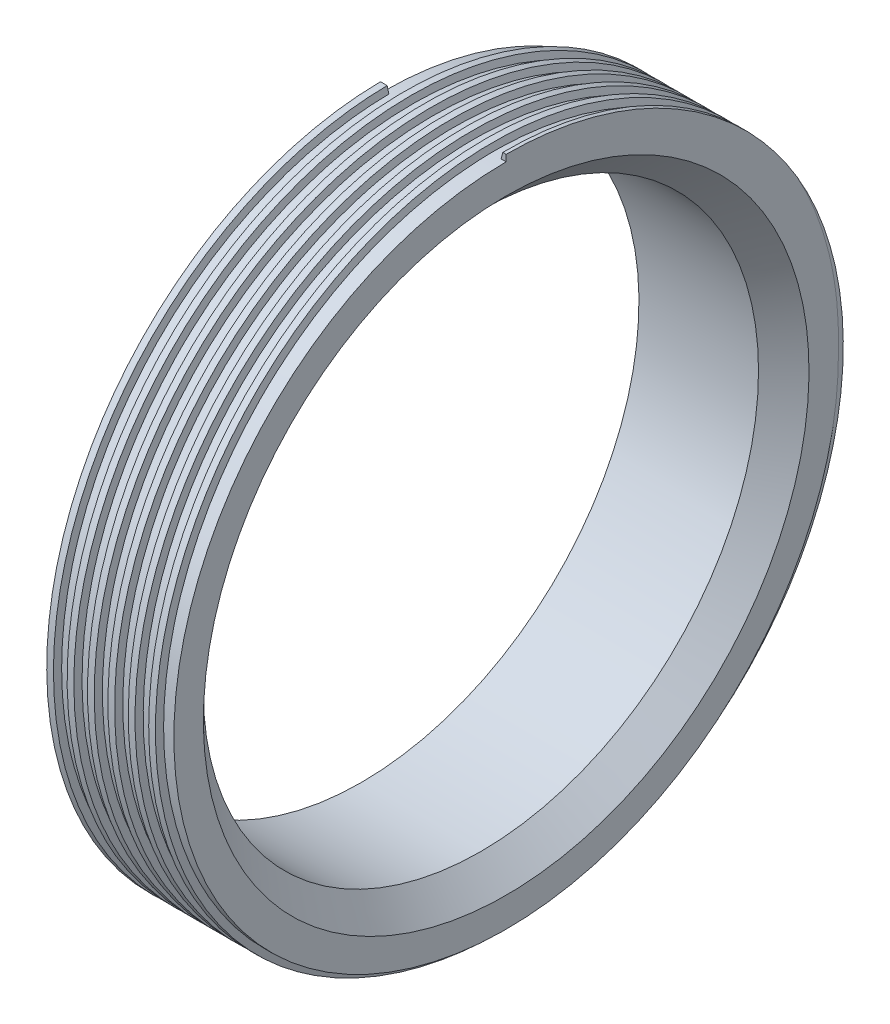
SolidWorks part; units mm, degrees
ref_plane "Front Plane" through (0, 0, 0) normal (0, 0, 1) x (1, 0, 0)
ref_plane "Top Plane" through (0, 0, 0) normal (0, 1, 0) x (1, 0, 0)
ref_plane "Right Plane" through (0, 0, 0) normal (1, 0, 0) x (0, 0, -1)
sketch "Sketch1" plane through (0, 0, 0) normal (0, 0, 1) x (1, 0, 0)
  line L0 (0, 0) -> (0, 50.8)
  line L1 (0, 50.8) -> (0.762, 50.8)
  line L2 (3.937, 53.975) -> (3.937, 59.436)
  line L3 (3.937, 59.436) -> (25.4, 59.436)
  line L4 (25.4, 59.436) -> (25.4, 0)
  line L5 (25.4, 0) -> (0, 0)
  arc A0 (3.937, 53.975) -> (0.762, 50.8) centre (0.762, 53.975) cw
  dimension ".125" = 3.175
  dimension "D1" = 50.8
  dimension "D2" = 21.463
  dimension "D3" = 25.4
  dimension "D4" = 59.436
revolve "Revolve1" add sketch "Sketch1" angle 360 about L5
sketch "Sketch3" plane through (25.4, 0, 0) normal (1, 0, 0) x (0, 0, -1)
  circle A1 centre (0, 0) radius 59.436
  circle A2 centre (0, 0) radius 59.436
  dimension "D1" = 0
curve "Helix/Spiral1"
sketch "Sketch10" plane through (25.4, 0, 0) normal (1, 0, 0) x (0, 0, -1)
  circle A2 centre (0, 0) radius 58.293
  circle A3 centre (0, 0) radius 58.293
  dimension "D1" = 1.143
extrude "Cut-Extrude14" cut sketch "Sketch10" against normal blind 21.463 flip side to cut
sketch "Sketch13" plane through (0, 0, 0) normal (0, 1, 0) x (1, 0, 0)
  line L0 (20.3405, 59.4359) -> (21.5166, 59.4359)
  line L1 (21.5166, 59.4359) -> (21.9928, 57.5944)
  line L2 (21.9928, 57.5944) -> (19.8643, 57.5944)
  line L3 (19.8643, 57.5944) -> (20.3405, 59.4359)
  line L4 (20.9285, 59.4359) -> (20.9285, 21.2583) construction
  dimension "D1" = 1.8415
  dimension "D2" = 1.176
  dimension "D3" = 14.5
  dimension "D4" = 14.5
sweep "Sweep1" add profiles "Sketch13" path "Helix/Spiral1"
sketch "Sketch16" plane through (0, 0, 0) normal (-1, 0, 0) x (0, 0, 1)
  circle A0 centre (0, 0) radius 48.6918
extrude "Cut-Extrude16" cut sketch "Sketch16" against normal blind 33.3248
chamfer "Chamfer1" distance 4.4298 angle 45 1 edges at (25.4, 48.6918, 0)
sketch "Sketch17" plane through (0, 0, 0) normal (0, 0, 1) x (1, 0, 0)
  line L1 (25.4, -58.293) -> (57.8826, -58.293)
  line L2 (25.4, -58.293) -> (25.4, 67.283)
  line L3 (25.4, 67.283) -> (57.8826, 67.283)
  line L4 (57.8826, -58.293) -> (57.8826, 67.283)
extrude "Cut-Extrude17" cut sketch "Sketch17" against normal mid plane 127
